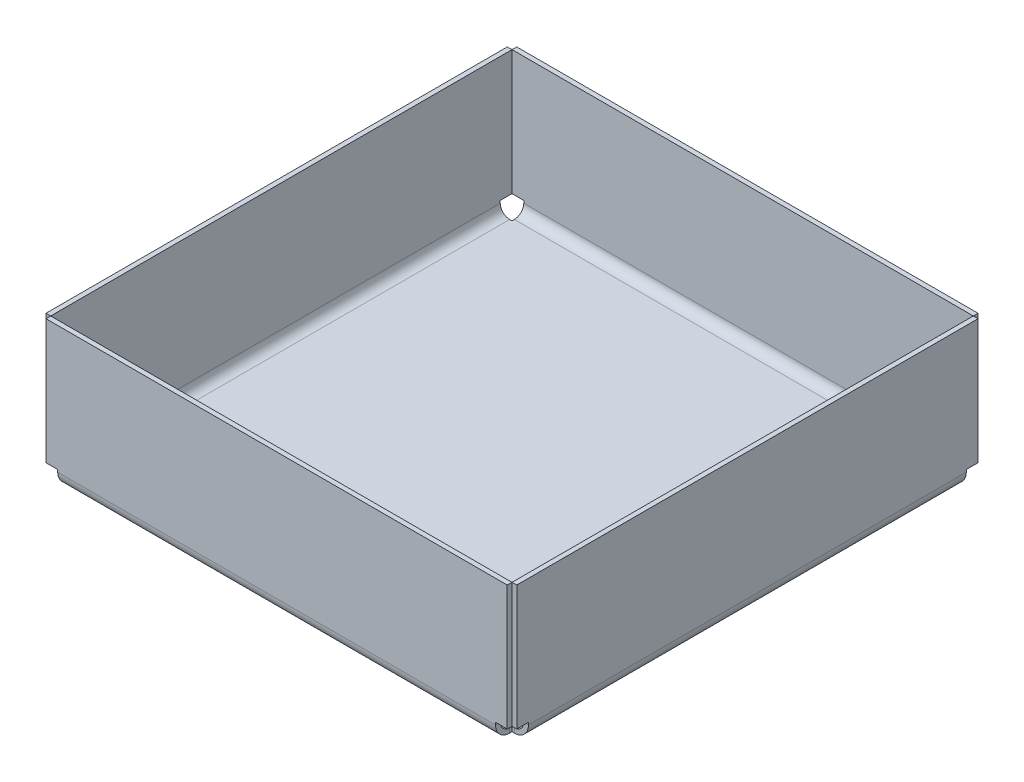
SolidWorks part; units mm, degrees
ref_plane "Front" through (0, 0, 0) normal (0, 0, 1) x (1, 0, 0)
ref_plane "Top" through (0, 0, 0) normal (0, 1, 0) x (1, 0, 0)
ref_plane "Right" through (0, 0, 0) normal (1, 0, 0) x (0, 0, -1)
sketch "Sketch1" plane through (0, 0, 0) normal (0, 1, 0) x (1, 0, 0)
  line L1 (0, 0) -> (100, 0)
  line L2 (0, 0) -> (0, 100)
  line L3 (0, 100) -> (100, 100)
  line L4 (100, 0) -> (100, 100)
  dimension "D1" = 100
extrude "Extrude1" add sketch "Sketch1" along normal blind 30
shell "Shell1" thickness 1
rip "Rip1"
sheet metal parameters "Sheet-Metal1" thickness 1 parameters "D1"=2
bend "SharpBend4" bend angle 90 parameters "D1"=0, "D5"=1
flatten bends "Flatten-Bends1" thickness 1 parameters "D1"=0
sketch "Sharp-Sketch1" plane through (0, 1, 0) normal (0, 1, 0) x (-1, 0, 0)
  line L0 (-96.5, -99.3562) -> (-3.5, -99.3562) construction
  line L1 (-99.3562, -3.5) -> (-99.3562, -96.5) construction
  line L2 (-3.5, -0.6438) -> (-96.5, -0.6438) construction
  line L3 (-0.6438, -96.5) -> (-0.6438, -3.5) construction
bend "SharpBend1" bend angle 90 parameters "D1"=0, "D5"=4
bend "SharpBend2" bend angle 90 parameters "D1"=0, "D5"=3
bend "SharpBend3" bend angle 90 parameters "D1"=0, "D5"=2
process bends "Process-Bends1" thickness 1 parameters "D1"=0
sketch "Flat-Sketch1" plane through (0, 1, 0) normal (0, 1, 0) x (-1, 0, 0)
